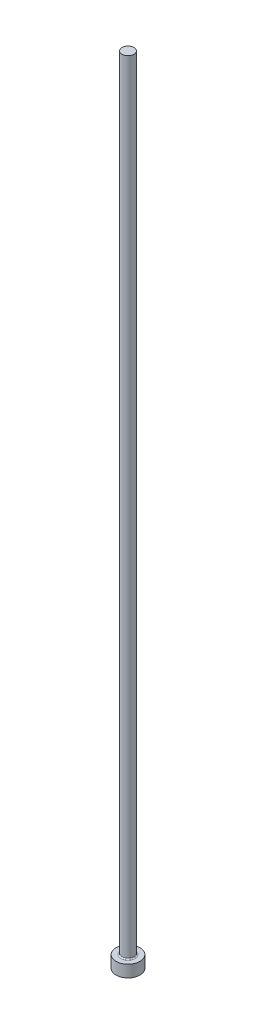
SolidWorks part; units mm, degrees
ref_plane "Plano frontal" through (0, 0, 0) normal (0, 0, 1) x (1, 0, 0)
ref_plane "Plano superior" through (0, 0, 0) normal (0, 1, 0) x (1, 0, 0)
ref_plane "Plano direito" through (0, 0, 0) normal (1, 0, 0) x (0, 0, -1)
sketch "Esboço1" plane through (0, 0, 0) normal (0, 0, 1) x (1, 0, 0)
  line L0 (0, 0) -> (3, 0)
  line L1 (3, 0) -> (3, 3)
  line L2 (3, 3) -> (1.8, 3)
  line L3 (1.5, 3.3) -> (1.5, 200)
  line L4 (1.5, 200) -> (0, 200)
  line L5 (0, 200) -> (0, 0) construction
  line L6 (0, 0) -> (0, 200)
  arc A0 (1.8, 3) -> (1.5, 3.3) centre (1.8, 3.3) cw
  dimension "D3" = 0.3
  dimension "D1" = 6
  dimension "D2" = 3
  dimension "D4" = 3
  dimension "D5" = 200
revolve "Revolução1" add sketch "Esboço1" angle 360 about L5
sketch "Esboço2"
  dimension "D1" = 1.6125
  dimension "D2" = 0.3375
  dimension "D3" = 0.525
  dimension "D4" = 0.225
wrap "Envolver1" sketch "Esboço2" wrap type deboss source sketch "Esboço2" thickness 0.1 parameters "D1"=0.1
